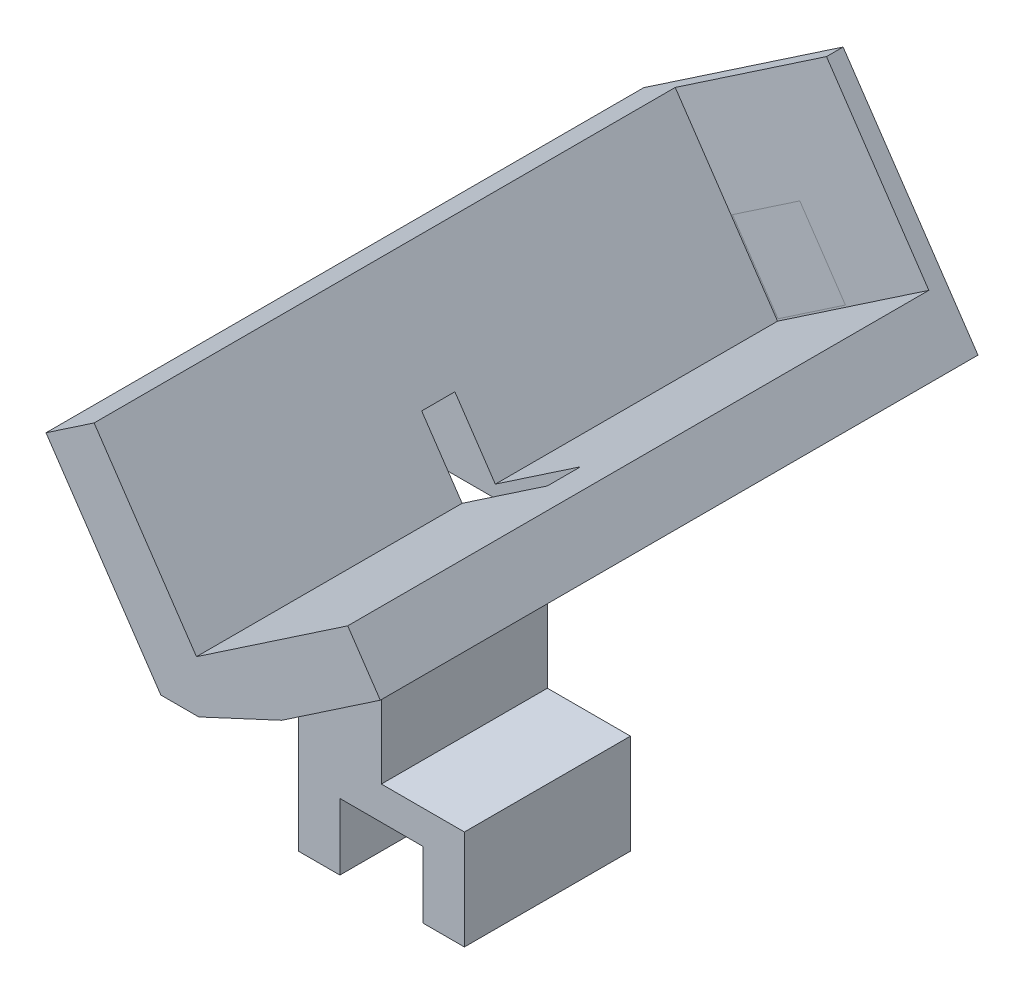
SolidWorks part; units mm, degrees
ref_plane "Front Plane" through (0, 0, 0) normal (0, 0, 1) x (1, 0, 0)
ref_plane "Top Plane" through (0, 0, 0) normal (0, 1, 0) x (1, 0, 0)
ref_plane "Right Plane" through (0, 0, 0) normal (1, 0, 0) x (0, 0, -1)
sketch "Sketch1" plane through (0, 0, 0) normal (0, 0, 1) x (1, 0, 0)
  line L0 (0, 0) -> (5, 0)
  line L1 (5, 0) -> (5, -4)
  line L2 (5, -4) -> (7.5, -4)
  line L3 (7.5, -4) -> (7.5, 2)
  line L4 (7.5, 2) -> (-2.5, 2)
  line L5 (-2.5, 2) -> (-2.5, -4)
  line L6 (-2.5, -4) -> (0, -4)
  line L7 (0, -4) -> (0, 0)
  dimension "D1" = 5
  dimension "D2" = 10
  dimension "D3" = 2
  dimension "D4" = 2.5
  dimension "D5" = 6
extrude "Extrude1" add sketch "Sketch1" along normal blind 10
sketch "Sketch2" plane through (0, 0, 10) normal (0, 0, 1) x (1, 0, 0)
  line L0 (7.5, 2) -> (-2.5, 2) construction
  line L1 (-2.5, 2) -> (2.5, 2)
  line L2 (-2.5, 2) -> (-2.5, 6)
  line L4 (2.5, 2) -> (2.5, 8.3254)
  line L5 (-2.5, 6) -> (-4.7827, 6)
  line L6 (-4.7827, 6) -> (-11.7008, 16.224)
  line L7 (-11.7008, 16.224) -> (-8.802, 18.1855)
  line L8 (-8.802, 18.1855) -> (-2.6375, 9.0751)
  line L9 (-2.6375, 9.0751) -> (6.4729, 15.2396)
  line L10 (6.4729, 15.2396) -> (8.4343, 12.3408)
  line L11 (8.4343, 12.3408) -> (2.5, 8.3254)
  line L13 (-2.5, 2) -> (-2.5, -4) construction
  dimension "D1" = 3.5
  dimension "D2" = 5
  dimension "D3" = 11
  dimension "D4" = 4
extrude "Extrude2" add sketch "Sketch2" against normal blind 10
sketch "Sketch3" plane through (0, 0, 0) normal (0, 0, -1) x (-1, 0, 0)
  line L0 (-2.5, 8.3254) -> (2.5, 6)
  line L16 (0, 0) -> (0, -4)
  line L17 (0, -4) -> (2.5, -4)
  line L18 (2.5, -4) -> (2.5, 6)
  line L19 (2.5, 6) -> (4.7827, 6)
  line L20 (4.7827, 6) -> (11.7008, 16.224)
  line L21 (11.7008, 16.224) -> (8.802, 18.1855)
  line L22 (8.802, 18.1855) -> (2.6375, 9.0751)
  line L23 (2.6375, 9.0751) -> (-6.4729, 15.2396)
  line L24 (-6.4729, 15.2396) -> (-8.4343, 12.3408)
  line L25 (-8.4343, 12.3408) -> (-2.5, 8.3254)
  line L26 (-2.5, 8.3254) -> (-2.5, 2)
  line L27 (-2.5, 2) -> (-7.5, 2)
  line L28 (-7.5, 2) -> (-7.5, -4)
  line L29 (-7.5, -4) -> (-5, -4)
  line L30 (-5, -4) -> (-5, 0)
  line L31 (-5, 0) -> (0, 0)
  line L35 (2.5, 6) -> (4.7827, 6)
  line L36 (4.7827, 6) -> (11.7008, 16.224)
  line L37 (11.7008, 16.224) -> (8.802, 18.1855)
  line L38 (8.802, 18.1855) -> (2.6375, 9.0751)
  line L39 (2.6375, 9.0751) -> (-6.4729, 15.2396)
  line L40 (-6.4729, 15.2396) -> (-8.4343, 12.3408)
  line L41 (-8.4343, 12.3408) -> (-2.5, 8.3254)
  dimension "D1" = 0
extrude "Extrude3" add sketch "Sketch3" along normal blind 20 and the other way blind 16
sketch "Sketch5" plane through (0, 0, 0) normal (0, 0, 1) x (1, 0, 0)
  line L1 (-10.0178, 12.6754) -> (2.5, 12.6754)
  line L2 (-10.0178, 12.6754) -> (-10.0178, 2)
  line L3 (-10.0178, 2) -> (2.5, 2)
  line L4 (2.5, 12.6754) -> (2.5, 2)
  line L5 (2.5, 2) -> (2.5, 8.3254) construction
extrude "Extrude5" cut sketch "Sketch5" against normal blind 2
sketch "Sketch6" plane through (0, 0, 0) normal (0, 0, -1) x (-1, 0, 0)
  line L0 (9.2996, 12.6754) -> (10.956, 11.5546)
  line L1 (10.956, 11.5546) -> (9.8352, 9.8981)
  line L2 (9.8352, 9.8981) -> (8.1788, 11.019)
  line L3 (4.7827, 6) -> (11.7008, 16.224) construction
  line L4 (8.1788, 11.019) -> (9.2996, 12.6754)
  line L5 (9.2996, 12.6754) -> (9.8352, 9.8981) construction
  line L6 (8.1788, 11.019) -> (10.956, 11.5546) construction
  circle A0 centre (9.5674, 11.2868) radius 0.5
  dimension "D1" = 1
  dimension "D2" = 2
  dimension "D3" = 2
extrude "Extrude6" add sketch "Sketch6" against normal blind 1
sketch "Sketch7" plane through (0, 0, -20) normal (0, 0, -1) x (-1, 0, 0)
  line L0 (2.6375, 9.0751) -> (-6.4729, 15.2396)
  line L1 (2.6375, 9.0751) -> (8.802, 18.1855)
  line L2 (-6.4729, 15.2396) -> (-0.3084, 24.35)
  line L3 (8.802, 18.1855) -> (-0.3084, 24.35)
  line L4 (11.7008, 16.224) -> (8.802, 18.1855) construction
extrude "Extrude7" add sketch "Sketch7" against normal blind 1
sketch "Sketch8" plane through (0, 0, -2) normal (0, 0, 1) x (1, 0, 0)
  line L1 (-9.6099, 8.3254) -> (2.5, 8.3254)
  line L2 (-9.6099, 8.3254) -> (-9.6099, 4.5836)
  line L3 (-9.6099, 4.5836) -> (2.5, 4.5836)
  line L4 (2.5, 8.3254) -> (2.5, 4.5836)
extrude "Extrude8" cut sketch "Sketch8" against normal through all
sketch "Sketch9" plane through (0, 0, -19) normal (0, 0, 1) x (1, 0, 0)
  line L0 (-5.4395, 13.2162) -> (-1.2985, 16.0182) construction
  line L1 (-2.6375, 9.0751) -> (-8.802, 18.1855) construction
  line L2 (-1.2985, 16.0182) -> (1.5036, 11.8771) construction
  line L3 (6.4729, 15.2396) -> (-2.6375, 9.0751) construction
  line L4 (-5.3567, 13.2722) -> (-2.6107, 9.214)
  line L5 (-2.6107, 9.214) -> (1.4475, 11.96)
  line L6 (-5.3567, 13.2722) -> (-1.2985, 16.0182)
  line L7 (-1.2985, 16.0182) -> (1.4475, 11.96)
  dimension "D1" = 5
  dimension "D2" = 4.9
